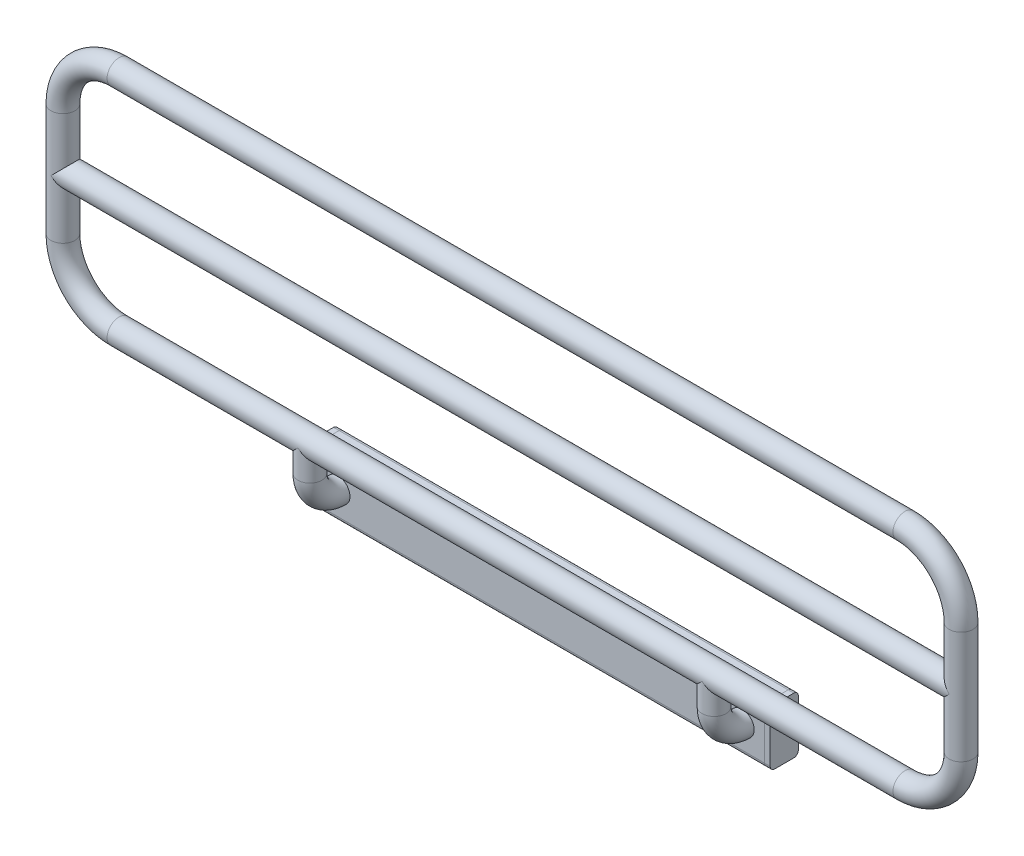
SolidWorks part; units mm, degrees
ref_plane "Front Plane" through (0, 0, 0) normal (0, 0, 1) x (1, 0, 0)
ref_plane "Top Plane" through (0, 0, 0) normal (0, 1, 0) x (1, 0, 0)
ref_plane "Right Plane" through (0, 0, 0) normal (1, 0, 0) x (0, 0, -1)
sketch3d "3DSketch1"
  line L0 (0, 0, 0) -> (155, 0, 0)
  line L1 (180, 50, 50) -> (350, 50, 50)
  line L2 (180, 25, 50) -> (180, 50, 50)
  line L3 (180, 50, 50) -> (0, 50, 50)
  line L4 (400, 100, 50) -> (400, 200, 50)
  line L5 (350, 250, 50) -> (0, 250, 50)
  line L6 (400, 150, 50) -> (0, 150, 50)
  arc A0 (400, 200, 50) -> (350, 250, 50) centre (350, 200, 50) ccw
  arc A1 (180, 0, 25) -> (155, 0, 0) centre (155, 0, 25) ccw
  arc A2 (180, 0, 25) -> (180, 25, 50) centre (180, 25, 25) ccw
  arc A3 (350, 50, 50) -> (400, 100, 50) centre (350, 100, 50) ccw
  point P12 (155, 25, 25)
  point P17 (280, 0, 50)
  point P18 (155, 25, 25)
  point P19 (400, 250, 50)
  point P20 (350, 200, 100)
  point P23 (400, 50, 50)
  point P24 (350, 100, 100)
  dimension "D4" = 400
  dimension "D5" = 25
  dimension "D6" = 50
  dimension "D1" = 50
  dimension "D2" = 200
  dimension "D3" = 180
other "Structural Member1"
ref_plane "Plane1" through (180, 50, 50) normal (-1, 0, 0) x (0, 0, 1)
sketch "Sketch1" plane through (180, 50, 50) normal (-1, 0, 0) x (0, 0, 1)
  circle A0 centre (0, 0) radius 7.8994
  circle A1 centre (0, 0) radius 10.668
  circle A2 centre (0, 0) radius 6.35 construction
  point P5 (0, 0)
  dimension "In_dia" = 15.7988
  dimension "Out_dia" = 21.336
  dimension "D1" = 12.7
mirror "Mirror1" about plane through (0, 0, 0) normal (1, 0, 0)
combine bodies "Combine1" operation type add bodies to combine 101 102 103 104 105 106 107 110 111 112 113 114 115 116 117 118 121 122
sketch "Sketch2" plane through (0, 0, 0) normal (1, 0, 0) x (0, 0, -1)
  line L0 (-25, -10.668) -> (-25, 10.668) construction
  line L1 (-21, 25) -> (-4, 25)
  line L2 (-25, 21) -> (-25, -21)
  line L3 (-21, -25) -> (-4, -25)
  line L4 (0, 21) -> (0, -21)
  line L5 (-25, 25) -> (0, -25) construction
  line L6 (-25, -25) -> (0, 25) construction
  line L7 (-21, -23) -> (-4, -23)
  line L8 (-2, 21) -> (-2, -21)
  line L9 (-21, 23) -> (-4, 23)
  line L10 (-23, 21) -> (-23, -21)
  arc A0 (-25, -21) -> (-21, -25) centre (-21, -21) ccw
  arc A1 (-4, -25) -> (0, -21) centre (-4, -21) ccw
  arc A2 (-4, 25) -> (0, 21) centre (-4, 21) cw
  arc A3 (-21, 25) -> (-25, 21) centre (-21, 21) ccw
  arc A4 (-4, -23) -> (-2, -21) centre (-4, -21) ccw
  arc A5 (-4, 23) -> (-2, 21) centre (-4, 21) cw
  arc A6 (-21, 23) -> (-23, 21) centre (-21, 21) ccw
  arc A7 (-23, -21) -> (-21, -23) centre (-21, -21) ccw
  point P0 (-12.5, 0)
  dimension "D3" = 4
  dimension "D1" = 50
  dimension "D2" = 25
  dimension "D4" = 2
extrude "Boss-Extrude1" add sketch "Sketch2" along normal mid plane 400 separate body
sketch "Sketch3" plane through (200, 0, 0) normal (1, 0, 0) x (0, 0, -1)
  line L4 (-21, -25) -> (-4, -25)
  line L5 (0, -21) -> (0, 21)
  line L6 (-4, 25) -> (-21, 25)
  line L7 (-25, 21) -> (-25, -21)
  line L8 (-21, -25) -> (-4, -25)
  line L9 (0, -21) -> (0, 21)
  line L10 (-4, 25) -> (-21, 25)
  line L11 (-25, 21) -> (-25, -21)
  arc A4 (-25, -21) -> (-21, -25) centre (-21, -21) ccw
  arc A5 (-4, -25) -> (0, -21) centre (-4, -21) ccw
  arc A6 (0, 21) -> (-4, 25) centre (-4, 21) ccw
  arc A7 (-21, 25) -> (-25, 21) centre (-21, 21) ccw
  arc A8 (-25, -21) -> (-21, -25) centre (-21, -21) ccw
  arc A9 (-4, -25) -> (0, -21) centre (-4, -21) ccw
  arc A10 (0, 21) -> (-4, 25) centre (-4, 21) ccw
  arc A11 (-21, 25) -> (-25, 21) centre (-21, 21) ccw
  dimension "D1" = 0
extrude "Boss-Extrude2" add sketch "Sketch3" along normal blind 5 separate body
mirror "Mirror2" about plane through (0, 0, 0) normal (1, 0, 0)
